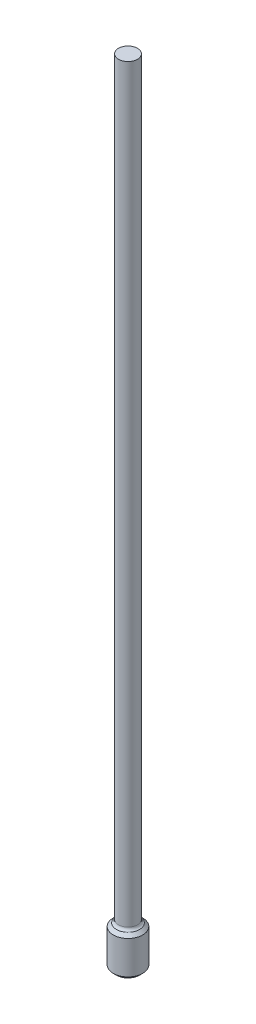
SolidWorks part; units mm, degrees
ref_plane "Front Plane" through (0, 0, 0) normal (0, 0, 1) x (1, 0, 0)
ref_plane "Top Plane" through (0, 0, 0) normal (0, 1, 0) x (1, 0, 0)
ref_plane "Right Plane" through (0, 0, 0) normal (1, 0, 0) x (0, 0, -1)
sketch "Sketch1" plane through (0, 0, 0) normal (0, 0, 1) x (1, 0, 0)
  line L0 (0, 259.9588) -> (0, -15.1925) construction
  line L1 (0, 0) -> (-1.1811, 0)
  line L2 (-1.1811, 0) -> (-1.1811, 3.175)
  line L3 (-1.1811, 3.175) -> (-0.762, 3.175)
  line L4 (-0.762, 3.175) -> (-0.762, 63.5)
  line L5 (-0.762, 63.5) -> (0, 63.5)
  line L6 (0, 63.5) -> (0, 0)
  dimension "L" = 63.5
  dimension "H" = 2.3622
  dimension "T" = 3.175
  dimension "D" = 1.524
revolve "Revolve1" add sketch "Sketch1" angle 360 about L0
chamfer "Chamfer1" distance 0.254 angle 45 2 edges at (0, 3.175, 1.1811) (0, 0, 1.1811)
fillet "Fillet1" radius 0.254 1 edges at (0, 3.175, 0.762)
